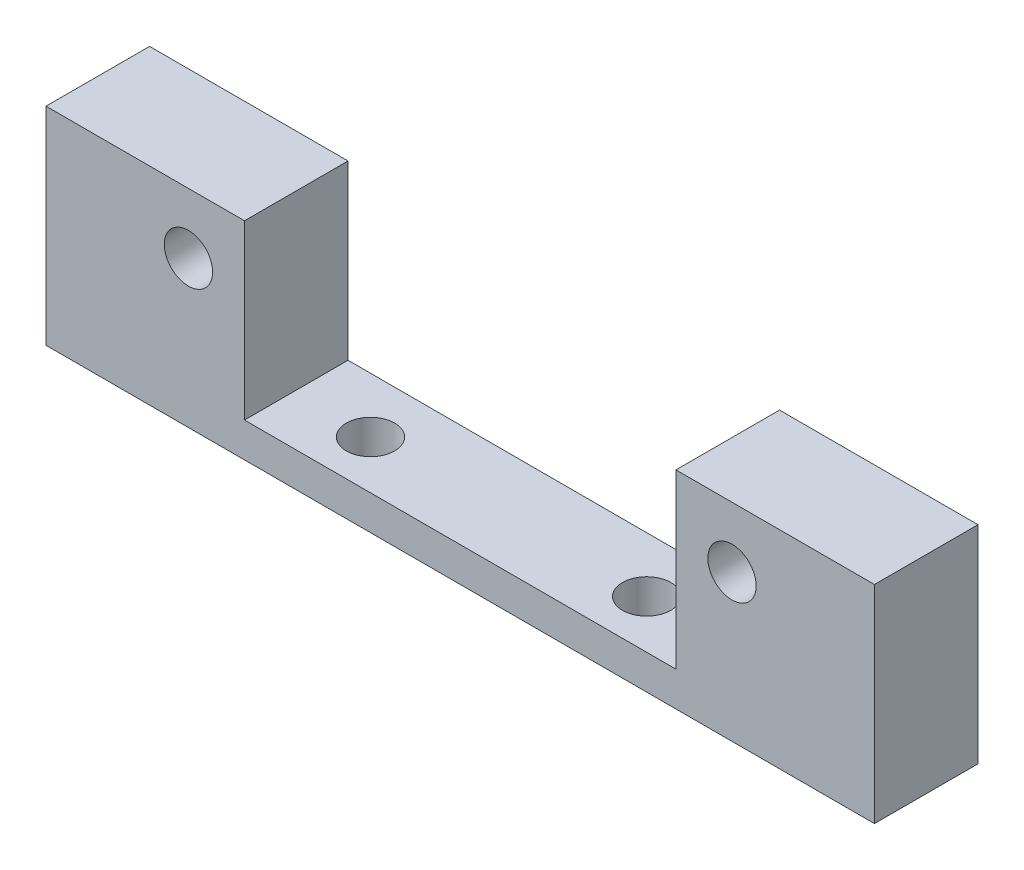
SolidWorks part; units mm, degrees
ref_plane "Front Plane" through (0, 0, 0) normal (0, 0, 1) x (1, 0, 0)
ref_plane "Top Plane" through (0, 0, 0) normal (0, 1, 0) x (1, 0, 0)
ref_plane "Right Plane" through (0, 0, 0) normal (1, 0, 0) x (0, 0, -1)
sketch "Sketch1" plane through (0, 0, 0) normal (0, 1, 0) x (1, 0, 0)
  line L1 (-76.2, -6.35) -> (76.2, -6.35)
  line L2 (-76.2, -6.35) -> (-76.2, 12.7)
  line L3 (-76.2, 12.7) -> (76.2, 12.7)
  line L4 (76.2, -6.35) -> (76.2, 12.7)
  dimension "D1" = 152.4
  dimension "D2" = 76.2
  dimension "D3" = 19.05
  dimension "D4" = 12.7
extrude "Boss-Extrude1" add sketch "Sketch1" against normal blind 38.1
sketch "Sketch2" plane through (0, 0, 0) normal (0, 1, 0) x (1, 0, 0)
  line L0 (76.2, 12.7) -> (-76.2, 12.7) construction
  circle A0 centre (-25.4, 2.54) radius 4.445
  circle A1 centre (25.4, 2.54) radius 4.445
  dimension "D3" = 8.89
  dimension "D4" = 8.89
  dimension "D1" = 50.8
  dimension "D2" = 25.4
  dimension "D5" = 10.16
  dimension "D6" = 10.16
extrude "Cut-Extrude1" cut sketch "Sketch2" against normal through all
sketch "Sketch3" plane through (0, 0, 6.35) normal (0, 0, 1) x (1, 0, 0)
  line L0 (-76.2, -38.1) -> (76.2, -38.1) construction
  circle A0 centre (-49.9999, -11.1252) radius 4.445
  circle A1 centre (49.9999, -11.1252) radius 4.445
  dimension "D3" = 8.89
  dimension "D4" = 8.89
  dimension "D1" = 99.9998
  dimension "D2" = 49.9999
  dimension "D5" = 26.9748
  dimension "D6" = 26.9748
extrude "Cut-Extrude2" cut sketch "Sketch3" against normal blind 38.1
sketch "Sketch4" plane through (0, 0, 6.35) normal (0, 0, 1) x (1, 0, 0)
  line L0 (-76.2, 0) -> (76.2, 0) construction
  line L1 (-39.6875, 0) -> (39.6875, 0)
  line L2 (-39.6875, 0) -> (-39.6875, -31.75)
  line L3 (-39.6875, -31.75) -> (39.6875, -31.75)
  line L4 (39.6875, 0) -> (39.6875, -31.75)
  line L5 (-76.2, -38.1) -> (76.2, -38.1) construction
  dimension "D1" = 79.375
  dimension "D2" = 39.6875
  dimension "D3" = 6.35
extrude "Cut-Extrude3" cut sketch "Sketch4" against normal through all
